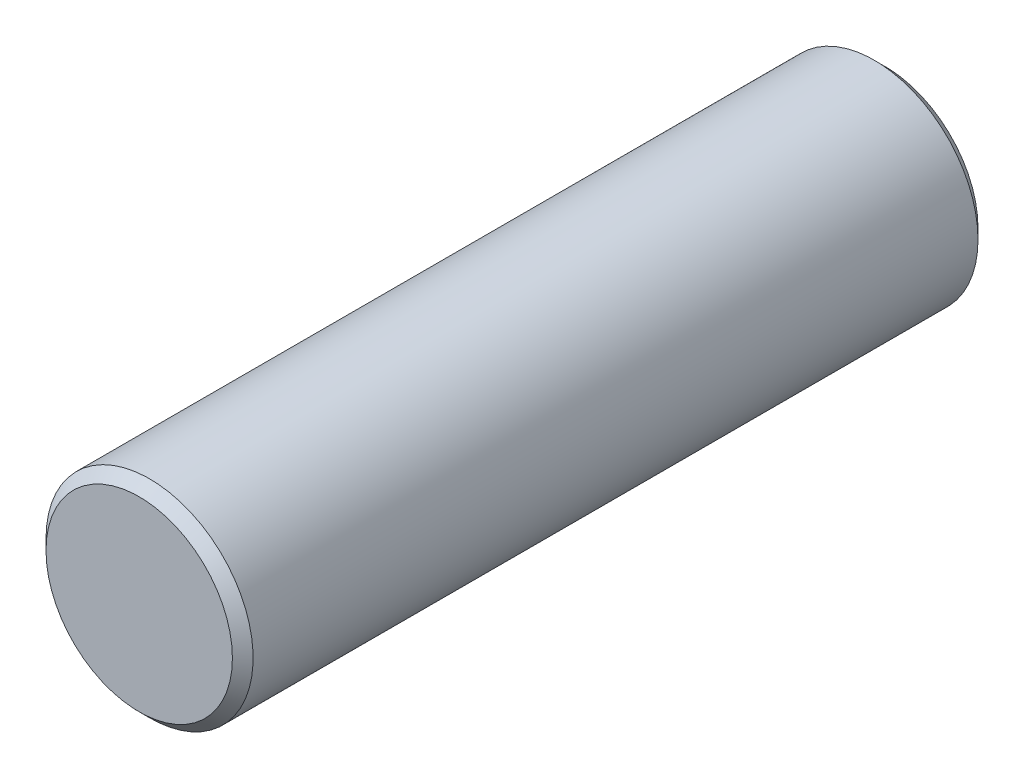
SolidWorks part; units mm, degrees
ref_plane "前视基准面" through (0, 0, 0) normal (0, 0, 1) x (1, 0, 0)
ref_plane "上视基准面" through (0, 0, 0) normal (0, 1, 0) x (1, 0, 0)
ref_plane "右视基准面" through (0, 0, 0) normal (1, 0, 0) x (0, 0, -1)
sketch "草图1" plane through (0, 0, 0) normal (0, 0, 1) x (1, 0, 0)
  circle A0 centre (0, 0) radius 1
  dimension "D1" = 2
extrude "凸台-拉伸1" add sketch "草图1" along normal mid plane 7.2
chamfer "倒角1" distance 0.1 angle 45 2 edges at (1, 0, -3.6) (1, 0, 3.6)
